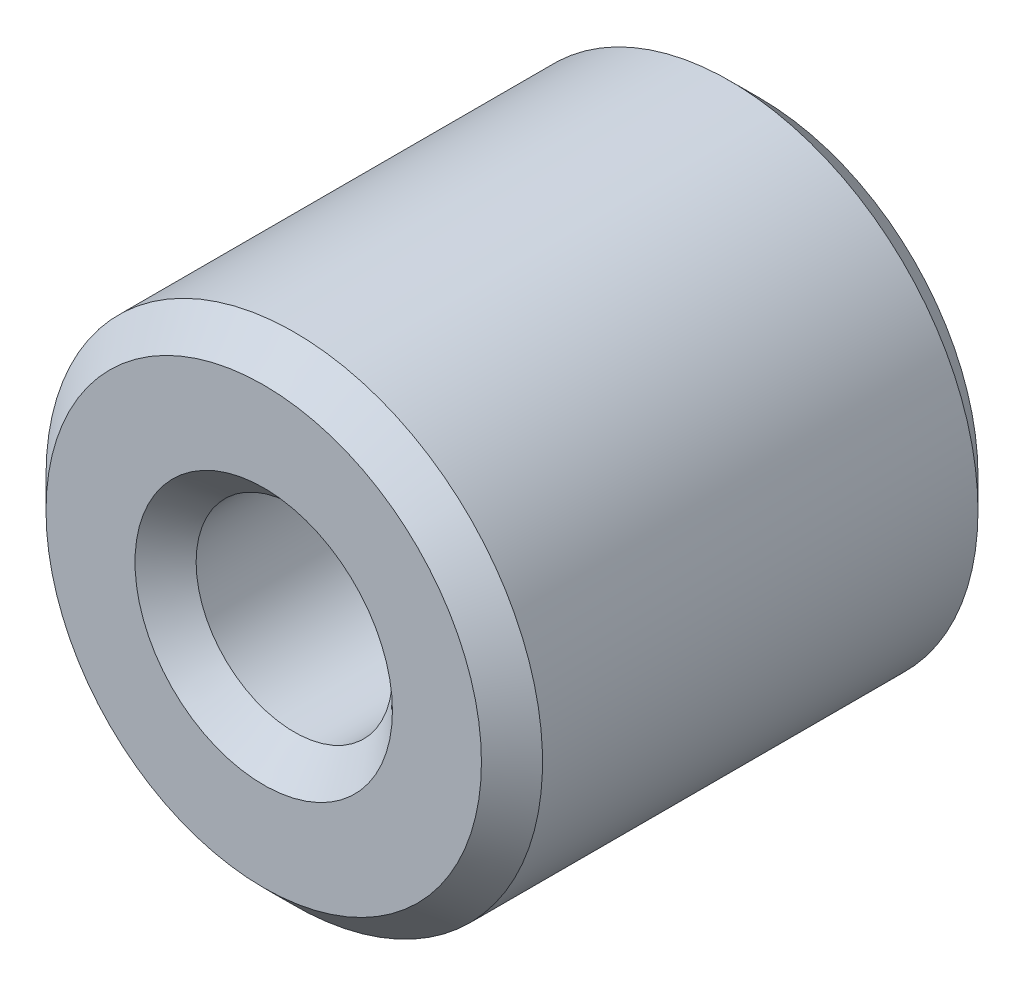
SolidWorks part; units mm, degrees
ref_plane "Front Plane" through (0, 0, 0) normal (0, 0, 1) x (1, 0, 0)
ref_plane "Top Plane" through (0, 0, 0) normal (0, 1, 0) x (1, 0, 0)
ref_plane "Right Plane" through (0, 0, 0) normal (1, 0, 0) x (0, 0, -1)
sketch "Sketch1" plane through (0, 0, 0) normal (0, 0, 1) x (1, 0, 0)
  circle A0 centre (0, 0) radius 2.57
  circle A1 centre (0, 0) radius 6.5
  dimension "D1" = 5.14
  dimension "D2" = 13
extrude "Boss-Extrude1" add sketch "Sketch1" along normal blind 13
chamfer "Chamfer1" distance 0.8 angle 45 4 edges at (2.57, 0, 0) (6.5, 0, 0) (2.57, 0, 13) (6.5, 0, 13)
